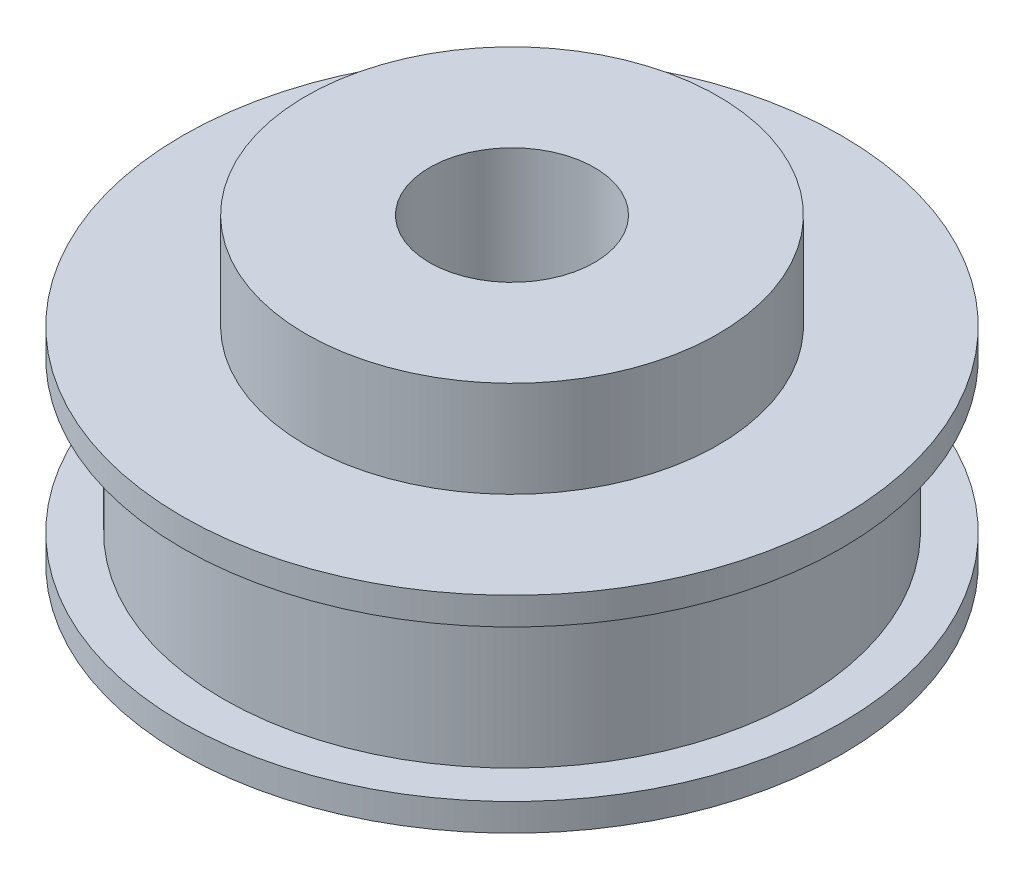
SolidWorks part; units mm, degrees
ref_plane "Alzado" through (0, 0, 0) normal (0, 0, 1) x (1, 0, 0)
ref_plane "Planta" through (0, 0, 0) normal (0, 1, 0) x (1, 0, 0)
ref_plane "Vista lateral" through (0, 0, 0) normal (1, 0, 0) x (0, 0, -1)
sketch "Croquis1" plane through (0, 0, 0) normal (0, 1, 0) x (1, 0, 0)
  circle A0 centre (0, 0) radius 24
extrude "Extruir1" add sketch "Croquis1" along normal blind 2
sketch "Croquis2" plane through (0, 2, 0) normal (0, 1, 0) x (1, 0, 0)
  circle A0 centre (0, 0) radius 21.02
extrude "Extruir2" add sketch "Croquis2" along normal blind 11
sketch "Croquis3" plane through (0, 13, 0) normal (0, 1, 0) x (1, 0, 0)
  circle A0 centre (0, 0) radius 24
extrude "Extruir3" add sketch "Croquis3" along normal blind 2
sketch "Croquis11" plane through (0, 15, 0) normal (0, 1, 0) x (1, 0, 0)
  circle A0 centre (0, 0) radius 15
extrude "Extruir7" add sketch "Croquis11" along normal blind 7
sketch "Croquis12" plane through (0, 22, 0) normal (0, 1, 0) x (1, 0, 0)
  point P0 (0, 0)
hole_wizard "Taladro de diámetro de Ø12.0 (12)1" positions "Croquis3D1" profile "Croquis13" hole size "Ø12.0" standard "ISO"
sketch3d "Croquis3D1"
  point P0 (0, 22, 0)
sketch "Croquis13" plane through (0, 22, 0) normal (1, 0, 0) x (0, 0, 1)
  line L0 (0, 0) -> (0, 22)
  line L1 (0, 22) -> (6, 22)
  line L2 (6, 22) -> (6, 0)
  line L5 (6, 0) -> (0, 0)
  line L11 (0, -6.35) -> (0, 107.95) construction
  dimension "Diámetro de taladro hasta el siguiente" = 12
  dimension "Profundidad de taladro hasta el siguiente" = 22
